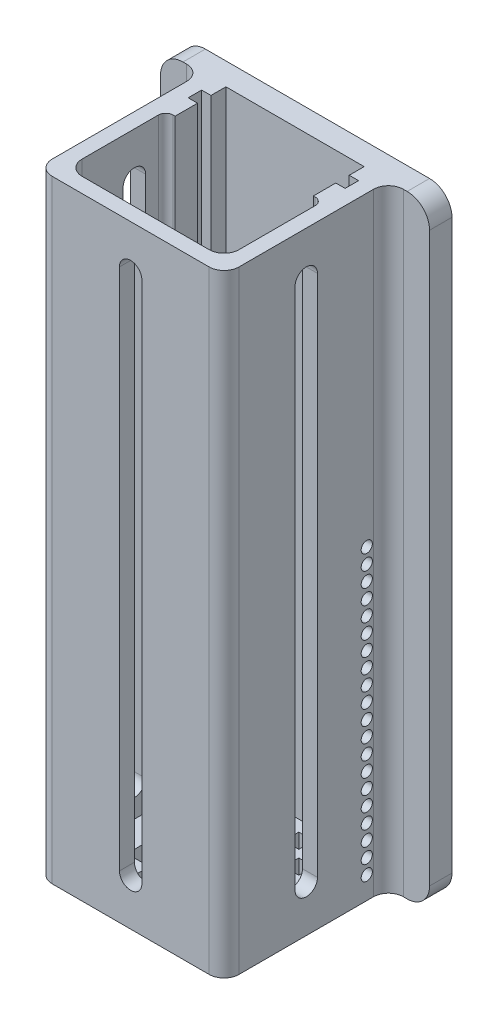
SolidWorks part; units mm, degrees
ref_plane "Plan de face" through (0, 0, 0) normal (0, 0, 1) x (1, 0, 0)
ref_plane "Plan de dessus" through (0, 0, 0) normal (0, 1, 0) x (1, 0, 0)
ref_plane "Plan de droite" through (0, 0, 0) normal (1, 0, 0) x (0, 0, -1)
sketch "Esquisse1" plane through (0, 0, 0) normal (0, 1, 0) x (1, 0, 0)
  line L0 (4, 7) -> (21, 7)
  line L1 (2, 5) -> (23, 5)
  line L2 (-5.5, 27) -> (-2, 27)
  line L3 (25, 25) -> (25, 7)
  line L4 (-5.5, 30) -> (-5.5, 27)
  line L5 (23, 19.2) -> (23, 9)
  line L6 (2, 25) -> (2, 23.2)
  line L7 (2, 23.2) -> (3.25, 23.2)
  line L8 (12.5, 30) -> (12.5, 14.7292) construction
  line L9 (2, 25) -> (3.25, 25)
  line L10 (3.25, 23.2) -> (3.25, 20.2)
  line L11 (3.25, 20.2) -> (3, 20.2)
  line L12 (3.25, 25) -> (3.25, 27)
  line L13 (2, 19.2) -> (2, 9)
  line L14 (2, 24.1) -> (5.4956, 24.1) construction
  line L16 (3.25, 27) -> (21.75, 27)
  line L17 (21.75, 25) -> (21.75, 27)
  line L18 (21.75, 20.2) -> (22, 20.2)
  line L19 (21.75, 23.2) -> (21.75, 20.2)
  line L20 (23, 25) -> (21.75, 25)
  line L21 (23, 23.2) -> (21.75, 23.2)
  line L22 (23, 25) -> (23, 23.2)
  line L24 (0, 25) -> (0, 7)
  line L25 (30.5, 30) -> (30.5, 27)
  line L26 (30.5, 27) -> (27, 27)
  line L27 (-5.5, 30) -> (30.5, 30)
  arc A0 (2, 19.2) -> (3, 20.2) centre (3, 19.2) cw
  arc A1 (23, 19.2) -> (22, 20.2) centre (22, 19.2) ccw
  arc A2 (4, 7) -> (2, 9) centre (4, 9) cw
  arc A3 (21, 7) -> (23, 9) centre (21, 9) ccw
  arc A4 (2, 5) -> (0, 7) centre (2, 7) cw
  arc A5 (23, 5) -> (25, 7) centre (23, 7) ccw
  arc A6 (27, 27) -> (25, 25) centre (27, 25) ccw
  arc A7 (0, 25) -> (-2, 27) centre (-2, 25) ccw
  point P27 (2, 20.2)
  point P30 (23, 20.2)
  point P39 (0, 5)
  point P42 (25, 5)
  point P45 (25, 27)
  point P48 (0, 27)
  dimension "D9" = 1
  dimension "D12" = 2
  dimension "D13" = 2
  dimension "D2" = 10.5
  dimension "D4" = 2
  dimension "D5" = 1.8
  dimension "D6" = 3
  dimension "D7" = 1.25
  dimension "D8" = 20
  dimension "D10" = 18
  dimension "D3" = 2
  dimension "D11" = 2
  dimension "D14" = 5.9
extrude "Extrusion1" add sketch "Esquisse1" along normal blind 80
sketch "Esquisse2" plane through (0, 0, 0) normal (0, -1, 0) x (1, 0, 0)
  line L8 (2, -19.2) -> (2, -9) construction
  line L9 (5.5, -8.5) -> (7.5, -8.5)
  line L10 (5.5, -8.5) -> (5.5, -10.5)
  line L11 (5.5, -10.5) -> (7.5, -10.5)
  line L12 (7.5, -8.5) -> (7.5, -10.5)
  line L13 (4, -7) -> (21, -7) construction
  line L14 (8.5, -8.5) -> (10.5, -8.5)
  line L15 (8.5, -8.5) -> (8.5, -10.5)
  line L16 (-5.5, -27) -> (-5.5, -30)
  line L17 (-5.5, -30) -> (30.5, -30)
  line L18 (30.5, -30) -> (30.5, -27)
  line L19 (30.5, -27) -> (27, -27)
  line L20 (25, -25) -> (25, -7)
  line L21 (23, -5) -> (2, -5)
  line L22 (0, -7) -> (0, -25)
  line L23 (-2, -27) -> (-5.5, -27)
  line L24 (-5.5, -27) -> (-5.5, -30)
  line L25 (-5.5, -30) -> (30.5, -30)
  line L26 (30.5, -30) -> (30.5, -27)
  line L27 (30.5, -27) -> (27, -27)
  line L28 (25, -25) -> (25, -7)
  line L29 (23, -5) -> (2, -5)
  line L30 (0, -7) -> (0, -25)
  line L31 (-2, -27) -> (-5.5, -27)
  line L32 (8.5, -10.5) -> (10.5, -10.5)
  line L33 (10.5, -8.5) -> (10.5, -10.5)
  line L34 (11.5, -8.5) -> (13.5, -8.5)
  line L35 (11.5, -8.5) -> (11.5, -10.5)
  line L36 (11.5, -10.5) -> (13.5, -10.5)
  line L37 (13.5, -8.5) -> (13.5, -10.5)
  line L38 (14.5, -8.5) -> (16.5, -8.5)
  line L39 (14.5, -8.5) -> (14.5, -10.5)
  line L40 (14.5, -10.5) -> (16.5, -10.5)
  line L41 (16.5, -8.5) -> (16.5, -10.5)
  line L42 (17.5, -8.5) -> (19.5, -8.5)
  line L43 (17.5, -8.5) -> (17.5, -10.5)
  line L44 (17.5, -10.5) -> (19.5, -10.5)
  line L45 (19.5, -8.5) -> (19.5, -10.5)
  line L46 (5.5, -11.5) -> (7.5, -11.5)
  line L47 (5.5, -11.5) -> (5.5, -13.5)
  line L48 (5.5, -13.5) -> (7.5, -13.5)
  line L49 (7.5, -11.5) -> (7.5, -13.5)
  line L50 (8.5, -11.5) -> (10.5, -11.5)
  line L51 (8.5, -11.5) -> (8.5, -13.5)
  line L52 (8.5, -13.5) -> (10.5, -13.5)
  line L53 (10.5, -11.5) -> (10.5, -13.5)
  line L54 (11.5, -11.5) -> (13.5, -11.5)
  line L55 (11.5, -11.5) -> (11.5, -13.5)
  line L56 (11.5, -13.5) -> (13.5, -13.5)
  line L57 (13.5, -11.5) -> (13.5, -13.5)
  line L58 (14.5, -11.5) -> (16.5, -11.5)
  line L59 (14.5, -11.5) -> (14.5, -13.5)
  line L60 (14.5, -13.5) -> (16.5, -13.5)
  line L61 (16.5, -11.5) -> (16.5, -13.5)
  line L62 (17.5, -11.5) -> (19.5, -11.5)
  line L63 (17.5, -11.5) -> (17.5, -13.5)
  line L64 (17.5, -13.5) -> (19.5, -13.5)
  line L65 (19.5, -11.5) -> (19.5, -13.5)
  line L66 (5.5, -14.5) -> (7.5, -14.5)
  line L67 (5.5, -14.5) -> (5.5, -16.5)
  line L68 (5.5, -16.5) -> (7.5, -16.5)
  line L69 (7.5, -14.5) -> (7.5, -16.5)
  line L70 (8.5, -14.5) -> (10.5, -14.5)
  line L71 (8.5, -14.5) -> (8.5, -16.5)
  line L72 (8.5, -16.5) -> (10.5, -16.5)
  line L73 (10.5, -14.5) -> (10.5, -16.5)
  line L74 (11.5, -14.5) -> (13.5, -14.5)
  line L75 (11.5, -14.5) -> (11.5, -16.5)
  line L76 (11.5, -16.5) -> (13.5, -16.5)
  line L77 (13.5, -14.5) -> (13.5, -16.5)
  line L78 (14.5, -14.5) -> (16.5, -14.5)
  line L79 (14.5, -14.5) -> (14.5, -16.5)
  line L80 (14.5, -16.5) -> (16.5, -16.5)
  line L81 (16.5, -14.5) -> (16.5, -16.5)
  line L82 (17.5, -14.5) -> (19.5, -14.5)
  line L83 (17.5, -14.5) -> (17.5, -16.5)
  line L84 (17.5, -16.5) -> (19.5, -16.5)
  line L85 (19.5, -14.5) -> (19.5, -16.5)
  line L86 (5.5, -17.5) -> (7.5, -17.5)
  line L87 (5.5, -17.5) -> (5.5, -19.5)
  line L88 (5.5, -19.5) -> (7.5, -19.5)
  line L89 (7.5, -17.5) -> (7.5, -19.5)
  line L90 (8.5, -17.5) -> (10.5, -17.5)
  line L91 (8.5, -17.5) -> (8.5, -19.5)
  line L92 (8.5, -19.5) -> (10.5, -19.5)
  line L93 (10.5, -17.5) -> (10.5, -19.5)
  line L94 (11.5, -17.5) -> (13.5, -17.5)
  line L95 (11.5, -17.5) -> (11.5, -19.5)
  line L96 (11.5, -19.5) -> (13.5, -19.5)
  line L97 (13.5, -17.5) -> (13.5, -19.5)
  line L98 (14.5, -17.5) -> (16.5, -17.5)
  line L99 (14.5, -17.5) -> (14.5, -19.5)
  line L100 (14.5, -19.5) -> (16.5, -19.5)
  line L101 (16.5, -17.5) -> (16.5, -19.5)
  line L102 (17.5, -17.5) -> (19.5, -17.5)
  line L103 (17.5, -17.5) -> (17.5, -19.5)
  line L104 (17.5, -19.5) -> (19.5, -19.5)
  line L105 (19.5, -17.5) -> (19.5, -19.5)
  line L106 (5.5, -20.5) -> (7.5, -20.5)
  line L107 (5.5, -20.5) -> (5.5, -22.5)
  line L108 (5.5, -22.5) -> (7.5, -22.5)
  line L109 (7.5, -20.5) -> (7.5, -22.5)
  line L110 (8.5, -20.5) -> (10.5, -20.5)
  line L111 (8.5, -20.5) -> (8.5, -22.5)
  line L112 (8.5, -22.5) -> (10.5, -22.5)
  line L113 (10.5, -20.5) -> (10.5, -22.5)
  line L114 (11.5, -20.5) -> (13.5, -20.5)
  line L115 (11.5, -20.5) -> (11.5, -22.5)
  line L116 (11.5, -22.5) -> (13.5, -22.5)
  line L117 (13.5, -20.5) -> (13.5, -22.5)
  line L118 (14.5, -20.5) -> (16.5, -20.5)
  line L119 (14.5, -20.5) -> (14.5, -22.5)
  line L120 (14.5, -22.5) -> (16.5, -22.5)
  line L121 (16.5, -20.5) -> (16.5, -22.5)
  line L122 (17.5, -20.5) -> (19.5, -20.5)
  line L123 (17.5, -20.5) -> (17.5, -22.5)
  line L124 (17.5, -22.5) -> (19.5, -22.5)
  line L125 (19.5, -20.5) -> (19.5, -22.5)
  line L126 (5.5, -23.5) -> (7.5, -23.5)
  line L127 (5.5, -23.5) -> (5.5, -25.5)
  line L128 (5.5, -25.5) -> (7.5, -25.5)
  line L129 (7.5, -23.5) -> (7.5, -25.5)
  line L130 (8.5, -23.5) -> (10.5, -23.5)
  line L131 (8.5, -23.5) -> (8.5, -25.5)
  line L132 (8.5, -25.5) -> (10.5, -25.5)
  line L133 (10.5, -23.5) -> (10.5, -25.5)
  line L134 (11.5, -23.5) -> (13.5, -23.5)
  line L135 (11.5, -23.5) -> (11.5, -25.5)
  line L136 (11.5, -25.5) -> (13.5, -25.5)
  line L137 (13.5, -23.5) -> (13.5, -25.5)
  line L138 (14.5, -23.5) -> (16.5, -23.5)
  line L139 (14.5, -23.5) -> (14.5, -25.5)
  line L140 (14.5, -25.5) -> (16.5, -25.5)
  line L141 (16.5, -23.5) -> (16.5, -25.5)
  line L142 (17.5, -23.5) -> (19.5, -23.5)
  line L143 (17.5, -23.5) -> (17.5, -25.5)
  line L144 (17.5, -25.5) -> (19.5, -25.5)
  line L145 (19.5, -23.5) -> (19.5, -25.5)
  line L146 (5.5, -8.5) -> (8.5, -8.5) construction
  line L147 (5.5, -8.5) -> (5.5, -11.5) construction
  arc A8 (25, -25) -> (27, -27) centre (27, -25) ccw
  arc A9 (25, -7) -> (23, -5) centre (23, -7) ccw
  arc A10 (2, -5) -> (0, -7) centre (2, -7) ccw
  arc A11 (-2, -27) -> (0, -25) centre (-2, -25) ccw
  arc A12 (25, -25) -> (27, -27) centre (27, -25) ccw
  arc A13 (25, -7) -> (23, -5) centre (23, -7) ccw
  arc A14 (2, -5) -> (0, -7) centre (2, -7) ccw
  arc A15 (-2, -27) -> (0, -25) centre (-2, -25) ccw
  dimension "D2" = 2
  dimension "D3" = 2
  dimension "D4" = 3.5
  dimension "D5" = 1.5
  dimension "D6" = 90
  dimension "D1" = 0
extrude "Extrusion2" add sketch "Esquisse2" along normal blind 2
sketch "Esquisse3" plane through (0, 0, -5) normal (0, 0, 1) x (1, 0, 0)
  line L0 (12.5, -2) -> (12.5, 80) construction
  line L1 (23, -2) -> (2, -2) construction
  line L2 (2, 80) -> (23, 80) construction
  line L3 (-5.5, 39) -> (35.6094, 39) construction
  line L4 (-5.5, 80) -> (-5.5, -2) construction
  line L5 (14, 4) -> (14, 74)
  line L6 (14, 39) -> (9.6147, 39) construction
  line L7 (11, 4) -> (11, 74)
  arc A0 (11, 74) -> (14, 74) centre (12.5, 74) cw
  arc A1 (11, 4) -> (14, 4) centre (12.5, 4) ccw
  dimension "D3" = 1.5
  dimension "D1" = 1.5
  dimension "D2" = 3
  dimension "D4" = 70
extrude "Enlèv. mat.-Extru.1" cut sketch "Esquisse3" against normal blind 2
sketch "Esquisse4" plane through (0, 0, 0) normal (-1, 0, 0) x (0, 0, 1)
  line L0 (-24.1, 80) -> (-24.1, -2) construction
  line L4 (-30, 80) -> (-30, -2) construction
  line L6 (-7, -2) -> (-25, -2) construction
  circle A0 centre (-24.1, 1) radius 0.75
  circle A1 centre (-24.1, 3) radius 0.75
  circle A2 centre (-24.1, 5) radius 0.75
  circle A3 centre (-24.1, 7) radius 0.75
  circle A4 centre (-24.1, 9) radius 0.75
  circle A5 centre (-24.1, 11) radius 0.75
  circle A6 centre (-24.1, 13) radius 0.75
  circle A7 centre (-24.1, 15) radius 0.75
  circle A8 centre (-24.1, 17) radius 0.75
  circle A9 centre (-24.1, 19) radius 0.75
  circle A10 centre (-24.1, 21) radius 0.75
  circle A11 centre (-24.1, 23) radius 0.75
  circle A12 centre (-24.1, 25) radius 0.75
  circle A13 centre (-24.1, 27) radius 0.75
  circle A14 centre (-24.1, 29) radius 0.75
  circle A15 centre (-24.1, 31) radius 0.75
  circle A16 centre (-24.1, 33) radius 0.75
  circle A17 centre (-24.1, 35) radius 0.75
  circle A18 centre (-24.1, 37) radius 0.75
  circle A19 centre (-24.1, 39) radius 0.75
  dimension "D2" = 3
  dimension "D1" = 5.9
extrude "Enlèv. mat.-Extru.2" cut sketch "Esquisse4" against normal through all
sketch "Esquisse5" plane through (0, 0, 0) normal (-1, 0, 0) x (0, 0, 1)
  line L0 (-16, 80) -> (-16, -2) construction
  line L1 (-25, 80) -> (-7, 80) construction
  line L2 (-7, -2) -> (-25, -2) construction
  line L3 (-14.5, 39) -> (-20.4741, 39) construction
  line L4 (-30, 39) -> (-5, 39) construction
  line L5 (-17.5, 74) -> (-17.5, 4)
  line L6 (-30, 80) -> (-30, -2) construction
  line L7 (-14.5, 74) -> (-14.5, 4)
  line L8 (-5, 80) -> (-5, -2) construction
  arc A0 (-17.5, 74) -> (-14.5, 74) centre (-16, 74) cw
  arc A1 (-17.5, 4) -> (-14.5, 4) centre (-16, 4) ccw
  dimension "D4" = 1.5
  dimension "D5" = 1.5
  dimension "D1" = 1.5
  dimension "D2" = 3
  dimension "D3" = 70
extrude "Enlèv. mat.-Extru.3" cut sketch "Esquisse5" against normal through all
fillet "Congé1" radius 3 4 edges at (30.5, -2, -28.5) (30.5, 80, -28.5) (-5.5, 80, -28.5) (-5.5, -2, -28.5)
